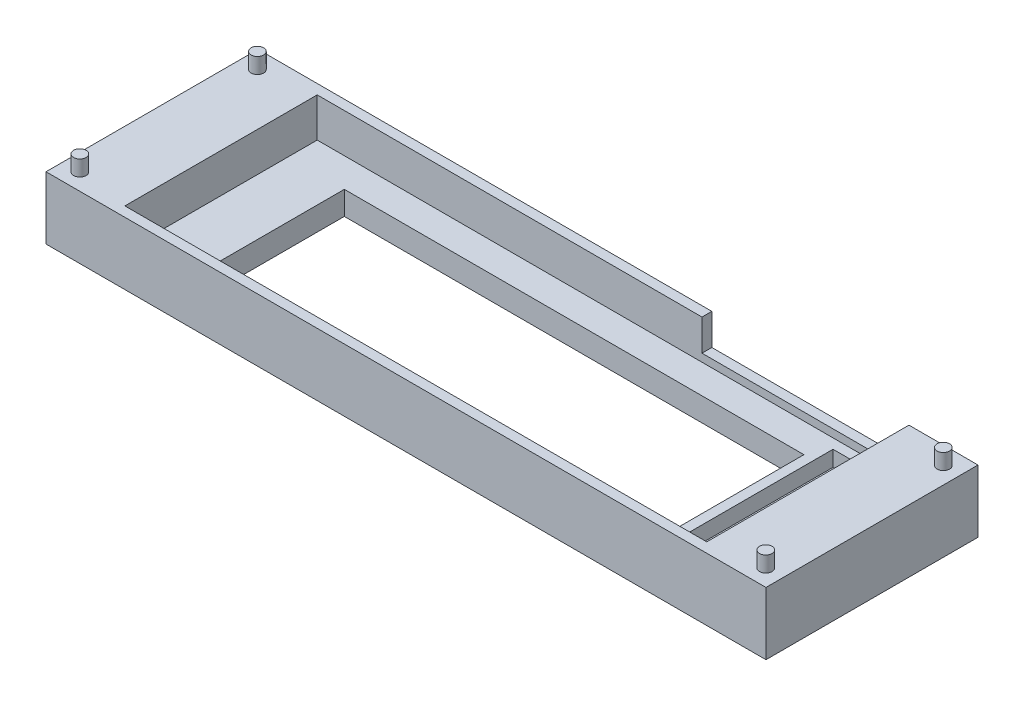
SolidWorks part; units mm, degrees
ref_plane "Front Plane" through (0, 0, 0) normal (0, 0, 1) x (1, 0, 0)
ref_plane "Top Plane" through (0, 0, 0) normal (0, 1, 0) x (1, 0, 0)
ref_plane "Right Plane" through (0, 0, 0) normal (1, 0, 0) x (0, 0, -1)
sketch "Sketch1" plane through (0, 0, 0) normal (0, 1, 0) x (1, 0, 0)
  line L1 (-59, 19.5) -> (59, 19.5)
  line L2 (-59, 19.5) -> (-59, -19.5)
  line L3 (-59, -19.5) -> (59, -19.5)
  line L4 (59, 19.5) -> (59, -19.5)
  line L5 (-73, 21.5) -> (73, 21.5)
  line L6 (-73, 21.5) -> (-73, -21.5)
  line L7 (-73, -21.5) -> (73, -21.5)
  line L8 (73, 21.5) -> (73, -21.5)
  dimension "D1" = 118
  dimension "D2" = 39
  dimension "D3" = 19.5
  dimension "D4" = 59
  dimension "D5" = 146
  dimension "D6" = 73
  dimension "D7" = 43
  dimension "D8" = 21.5
extrude "Boss-Extrude1" add sketch "Sketch1" along normal blind 6.35
sketch "Sketch2" plane through (0, 6.35, 0) normal (0, 1, 0) x (1, 0, 0)
  line L0 (73, -21.5) -> (73, 21.5) construction
  line L1 (59, 21.5) -> (19.025, 21.5)
  line L2 (59, 21.5) -> (59, 19.5)
  line L3 (59, 19.5) -> (19.025, 19.5)
  line L4 (19.025, 21.5) -> (19.025, 19.5)
  line L5 (59, 19.5) -> (-59, 19.5) construction
  line L6 (73, 21.5) -> (-73, 21.5) construction
  line L7 (59, -19.5) -> (59, 19.5) construction
  dimension "D2" = 53.975
extrude "Cut-Extrude1" cut sketch "Sketch2" against normal through all and the other way through all
sketch "Sketch3" plane through (0, 6.35, 0) normal (0, 1, 0) x (1, 0, 0)
  line L0 (73, -21.5) -> (73, 21.5) construction
  line L1 (73, 21.5) -> (59, 21.5) construction
  circle A0 centre (-69.53, 17.9) radius 1.27
  circle A1 centre (-69.53, -18.1) radius 1.27
  circle A2 centre (69.57, -18.1) radius 1.27
  circle A3 centre (69.57, 17.9) radius 1.27
  dimension "D1" = 2.54
  dimension "D2" = 139.1
  dimension "D3" = 3.43
  dimension "D4" = 36
  dimension "D5" = 3.6
extrude "Boss-Extrude2" add sketch "Sketch3" along normal blind 3.175
sketch "Sketch5" plane through (0, 0, 0) normal (0, -1, 0) x (1, 0, 0)
  line L1 (-73, -21.5) -> (73, -21.5)
  line L2 (-73, -21.5) -> (-73, 21.5)
  line L3 (-73, 21.5) -> (73, 21.5)
  line L4 (73, -21.5) -> (73, 21.5)
  line L5 (-59, -19.5) -> (59, -19.5)
  line L6 (-59, -19.5) -> (-59, 19.5)
  line L7 (-59, 19.5) -> (59, 19.5)
  line L8 (59, -19.5) -> (59, 19.5)
extrude "Boss-Extrude3" add sketch "Sketch5" along normal blind 1.5875
sketch "Sketch6" plane through (0, -1.5875, 0) normal (0, -1, 0) x (1, 0, 0)
  line L1 (-73, -21.5) -> (73, -21.5)
  line L2 (-73, -21.5) -> (-73, 21.5)
  line L3 (-73, 21.5) -> (73, 21.5)
  line L4 (73, -21.5) -> (73, 21.5)
  line L5 (-47.6, -13.6) -> (45.6, -13.6)
  line L6 (-47.6, -13.6) -> (-47.6, 14.4)
  line L7 (-47.6, 14.4) -> (45.6, 14.4)
  line L8 (45.6, -13.6) -> (45.6, 14.4)
  line L9 (59, 19.5) -> (59, -21.5) construction
  line L10 (19.025, -19.5) -> (59, -19.5) construction
  dimension "D1" = 93.2
  dimension "D2" = 28
  dimension "D3" = 13.4
  dimension "D4" = 5.9
extrude "Boss-Extrude4" add sketch "Sketch6" along normal blind 4.7625
sketch "Sketch7" plane through (0, -1.5875, 0) normal (0, 1, 0) x (1, 0, 0)
  line L1 (47.6, 17.5) -> (57, 17.5)
  line L2 (47.6, 17.5) -> (47.6, -17.5)
  line L3 (47.6, -17.5) -> (57, -17.5)
  line L4 (57, 17.5) -> (57, -17.5)
  line L6 (59, 19.5) -> (59, -19.5) construction
  line L7 (45.6, 13.6) -> (45.6, -14.4) construction
  line L8 (-59, 19.5) -> (59, 19.5) construction
  line L9 (59, -19.5) -> (-59, -19.5) construction
  dimension "D1" = 2
  dimension "D2" = 2
  dimension "D3" = 2
  dimension "D4" = 2
extrude "Cut-Extrude2" cut sketch "Sketch7" against normal blind 3.175
